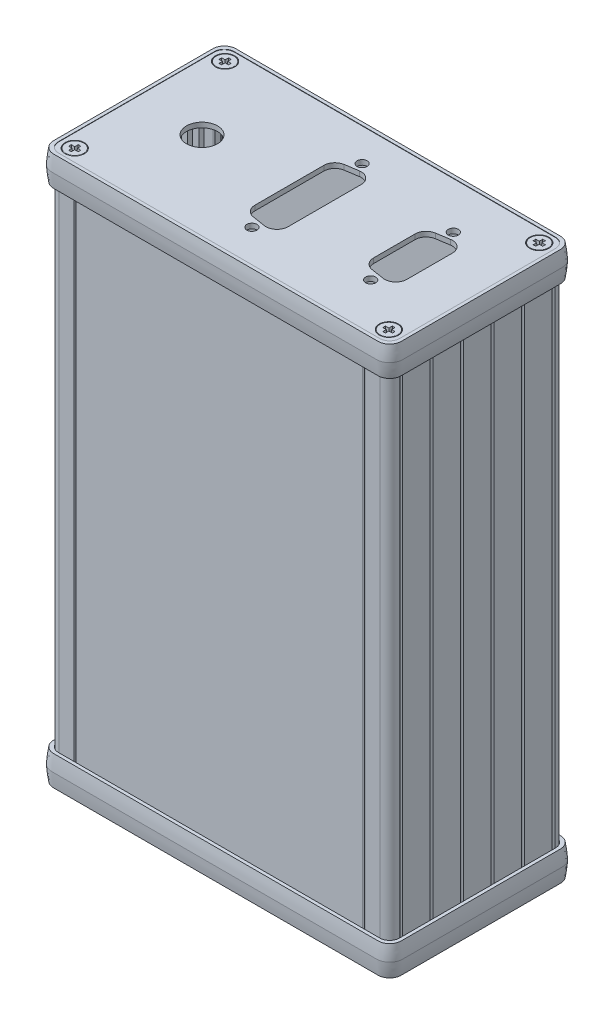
SolidWorks part; units mm, degrees
ref_plane "Front Plane" through (0, 0, 0) normal (0, 0, 1) x (1, 0, 0)
ref_plane "Top Plane" through (0, 0, 0) normal (0, 1, 0) x (1, 0, 0)
ref_plane "Right Plane" through (0, 0, 0) normal (1, 0, 0) x (0, 0, -1)
sketch "Sketch1" plane through (0, 0, 0) normal (0, 0, 1) x (1, 0, 0)
  line L0 (-53.065, -83) -> (53.065, -83)
  line L1 (-51.5, -80) -> (51.5, -80)
  line L2 (-51.5, -80) -> (-51.5, 80)
  line L3 (-51.5, 80) -> (51.5, 80)
  line L4 (51.5, -80) -> (51.5, 80)
  line L5 (0, 78.5) -> (0, -80) construction
  line L6 (-51.5, 0) -> (51.5, 0) construction
  line L7 (-53.065, 83) -> (53.065, 83)
  line L8 (-53.065, 83) -> (-53.065, 74)
  line L9 (-53.065, 74) -> (53.065, 74)
  line L10 (53.065, 83) -> (53.065, 74)
  line L11 (0, 78.5) -> (0, 83) construction
  line L12 (-53.065, 78.5) -> (53.065, 78.5) construction
  line L13 (53.065, -83) -> (53.065, -74)
  line L14 (-53.065, -74) -> (53.065, -74)
  line L15 (-53.065, -83) -> (-53.065, -74)
  point P0 (0, 0)
  point P4 (0, 78.5)
  point P11 (0, 81.3998)
  point P12 (0, 81.5)
  dimension "D1" = 9
  dimension "D2" = 1.5
  dimension "Width" = 103
  dimension "Height" = 160
  dimension "Bezel Width" = 106.13
  dimension "Inside Height" = 160
  dimension "D3" = 6
  dimension "Endplate Cover" = 1.6002
  dimension "D4" = 1.5
sketch "Sketch2" plane through (0, 0, 0) normal (0, 1, 0) x (1, 0, 0)
  line L0 (-53.065, 0) -> (53.065, 0) construction
  line L1 (-53.065, 0) -> (53.065, 0) construction
  line L3 (-51.5, -26.5) -> (51.5, -26.5)
  line L4 (-51.5, -26.5) -> (-51.5, 26.5)
  line L5 (-51.5, 26.5) -> (51.5, 26.5)
  line L6 (51.5, -26.5) -> (51.5, 26.5)
  line L7 (0, 26.5) -> (0, -26.5) construction
  line L8 (-51.5, 0) -> (51.5, 0) construction
  line L9 (-47.5, -24.81) -> (47.5, -24.81)
  line L10 (-47.5, -24.81) -> (-47.5, 24.81)
  line L11 (-47.5, 24.81) -> (47.5, 24.81)
  line L12 (47.5, -24.81) -> (47.5, 24.81)
  line L13 (0, 24.81) -> (0, -24.81) construction
  line L14 (-47.5, 0) -> (47.5, 0) construction
  line L15 (-47.5, -18.4) -> (-50, -18.4)
  line L16 (-50, -18.4) -> (-50, -16.4)
  line L17 (-50, -16.4) -> (-47.5, -16.4)
  line L18 (-47.5, -14.9) -> (-50, -14.9)
  line L19 (-50, -14.9) -> (-50, -12.9)
  line L20 (-50, -12.9) -> (-47.5, -12.9)
  line L21 (-47.5, -24.81) -> (-47.5, -18.4) construction
  point P2 (0, 0)
  point P8 (0, 0)
  point P15 (50, 0)
  point P18 (-50, 0)
  dimension "D1" = 6.41
  dimension "D2" = 2.5
  dimension "Depth" = 53
  dimension "Inside Depth" = 49.62
  dimension "Inside Width" = 95
  dimension "D4" = 100
  dimension "D6" = 2
  dimension "D7" = 1.5
sketch "Sketch3" plane through (0, 0, 0) normal (0, 1, 0) x (1, 0, 0)
  line L0 (0, 26.5) -> (0, -26.5) construction
  line L1 (-51.56, -26.545) -> (51.56, -26.545)
  line L2 (-51.56, -26.545) -> (-51.56, 26.545)
  line L3 (-51.56, 26.545) -> (51.56, 26.545)
  line L4 (51.56, -26.545) -> (51.56, 26.545)
  line L5 (0, 26.545) -> (0, -26.545) construction
  line L6 (-51.56, 0) -> (51.56, 0) construction
  circle A0 centre (-47.5, 22.735) radius 2.921
  circle A1 centre (-47.5, 22.735) radius 2.0955
  circle A2 centre (47.5, 22.735) radius 2.0955
  circle A3 centre (47.5, 22.735) radius 2.921
  point P0 (0, 0)
  dimension "D1" = 4.191
  dimension "D2" = 5.842
  dimension "Endplate Width" = 103.12
  dimension "Endplate Depth" = 53.09
  dimension "D3" = 45.47
  dimension "Mounting Hole Center to Center" = 95
sketch "Sketch4" plane through (0, 0, 0) normal (0, 1, 0) x (1, 0, 0)
  line L0 (-53.065, 0) -> (53.065, 0) construction
  line L1 (-53.065, -28.065) -> (53.065, -28.065)
  line L2 (-53.065, -28.065) -> (-53.065, 28.065)
  line L3 (-53.065, 28.065) -> (53.065, 28.065)
  line L4 (53.065, -28.065) -> (53.065, 28.065)
  line L5 (0, 28.065) -> (0, -28.065) construction
  line L6 (-53.065, 0) -> (53.065, 0) construction
  line L8 (-48.55, -24.35) -> (48.55, -24.35)
  line L9 (-48.55, -24.35) -> (-48.55, 24.35)
  line L10 (-48.55, 24.35) -> (48.55, 24.35)
  line L11 (48.55, -24.35) -> (48.55, 24.35)
  line L12 (0, 24.35) -> (0, -24.35) construction
  line L13 (-48.55, 0) -> (48.55, 0) construction
  line L14 (51.565, -26.565) -> (51.565, 26.565)
  line L15 (-51.565, 26.565) -> (51.565, 26.565)
  line L16 (-51.565, -26.565) -> (-51.565, 26.565)
  line L17 (-51.565, -26.565) -> (51.565, -26.565)
  point P0 (0, 0)
  point P6 (53.065, 0)
  point P7 (0, 0)
  point P21 (-47.5, 0)
  dimension "D1" = 97.1
  dimension "D2" = 48.7
  dimension "Bezel Depth" = 56.13
  dimension "D4" = 1.5
ref_plane "Plane1" through (0, 78.5, 0) normal (0, 1, 0) x (1, 0, 0)
sketch "Sketch5" plane through (0, 78.5, 0) normal (0, 1, 0) x (1, 0, 0)
  line L0 (53.065, -28.065) -> (53.065, 28.065) construction
  line L1 (-53.065, -28.065) -> (53.065, -28.065) construction
  line L2 (-53.065, 28.065) -> (53.065, 28.065) construction
  line L3 (-53.065, -28.065) -> (-53.065, 28.065) construction
  line L4 (53.065, -24.065) -> (53.065, 24.065)
  line L5 (-49.065, -28.065) -> (49.065, -28.065)
  line L6 (-49.065, 28.065) -> (49.065, 28.065)
  line L7 (-53.065, -24.065) -> (-53.065, 24.065)
  arc A0 (53.065, -24.065) -> (49.065, -28.065) centre (49.065, -24.065) cw
  arc A1 (53.065, 24.065) -> (49.065, 28.065) centre (49.065, 24.065) ccw
  arc A2 (-49.065, 28.065) -> (-53.065, 24.065) centre (-49.065, 24.065) ccw
  arc A3 (-49.065, -28.065) -> (-53.065, -24.065) centre (-49.065, -24.065) cw
  dimension "D1" = 4
ref_plane "Plane2" through (0, 83, 0) normal (0, 1, 0) x (1, 0, 0)
sketch "Sketch6" plane through (0, 83, 0) normal (0, 1, 0) x (1, 0, 0)
  line L0 (52.565, -24.065) -> (52.565, 24.065)
  line L1 (49.065, 27.565) -> (-49.065, 27.565)
  line L2 (-52.565, 24.065) -> (-52.565, -24.065)
  line L3 (-49.065, -27.565) -> (49.065, -27.565)
  line L4 (53.065, -24.065) -> (53.065, 24.065)
  line L5 (49.065, 28.065) -> (-49.065, 28.065)
  line L6 (-53.065, 24.065) -> (-53.065, -24.065)
  line L7 (-49.065, -28.065) -> (49.065, -28.065)
  line L8 (53.065, -24.065) -> (53.065, 24.065) construction
  line L9 (49.065, 28.065) -> (-49.065, 28.065) construction
  line L10 (-53.065, 24.065) -> (-53.065, -24.065) construction
  line L11 (-49.065, -28.065) -> (49.065, -28.065) construction
  arc A0 (52.565, 24.065) -> (49.065, 27.565) centre (49.065, 24.065) ccw
  arc A1 (-49.065, 27.565) -> (-52.565, 24.065) centre (-49.065, 24.065) ccw
  arc A2 (-52.565, -24.065) -> (-49.065, -27.565) centre (-49.065, -24.065) ccw
  arc A3 (49.065, -27.565) -> (52.565, -24.065) centre (49.065, -24.065) ccw
  arc A4 (53.065, 24.065) -> (49.065, 28.065) centre (49.065, 24.065) ccw
  arc A5 (-49.065, 28.065) -> (-53.065, 24.065) centre (-49.065, 24.065) ccw
  arc A6 (-53.065, -24.065) -> (-49.065, -28.065) centre (-49.065, -24.065) ccw
  arc A7 (49.065, -28.065) -> (53.065, -24.065) centre (49.065, -24.065) ccw
  arc A8 (53.065, 24.065) -> (49.065, 28.065) centre (49.065, 24.065) ccw construction
  arc A9 (-49.065, 28.065) -> (-53.065, 24.065) centre (-49.065, 24.065) ccw construction
  arc A10 (-53.065, -24.065) -> (-49.065, -28.065) centre (-49.065, -24.065) ccw construction
  arc A11 (49.065, -28.065) -> (53.065, -24.065) centre (49.065, -24.065) ccw construction
  dimension "D1" = 0
  dimension "D2" = 0.5
sketch "Sketch7" plane through (0, 0, 0) normal (0, 0, 1) x (1, 0, 0)
  line L2 (-53.065, 83) -> (-53.065, 74) construction
  arc A0 (-53.065, 78.5) -> (-52.565, 83) centre (-32.565, 78.5) cw
  point P0 (-52.565, 83)
sketch "Sketch8" plane through (0, 0, 0) normal (0, 0, 1) x (1, 0, 0)
  line L0 (0, 78.5) -> (0, 83) construction
  line L1 (0, 78.5) -> (0, 83) construction
  arc A0 (-52.565, 83) -> (-53.065, 78.5) centre (-32.565, 78.5) ccw construction
  arc A1 (-52.565, 83) -> (-53.065, 78.5) centre (-32.565, 78.5) ccw construction
  arc A2 (52.565, 83) -> (53.065, 78.5) centre (32.565, 78.5) cw
sketch "Sketch9" plane through (0, 0, 0) normal (1, 0, 0) x (0, 0, -1)
  line L0 (28.065, 78.5) -> (24.065, 78.5) construction
  line L1 (28.065, 78.5) -> (24.065, 78.5) construction
  line L2 (-24.065, 78.5) -> (24.065, 78.5) construction
  arc A0 (28.065, 78.5) -> (27.565, 83) centre (7.565, 78.5) ccw
  point P0 (27.565, 83)
sketch "Sketch10" plane through (0, 0, 0) normal (1, 0, 0) x (0, 0, -1)
  line L0 (0, 83) -> (0, 31.8992) construction
  line L1 (-24.065, 83) -> (24.065, 83) construction
  line L2 (0, 78.5) -> (0, 83) construction
  arc A0 (28.065, 78.5) -> (27.565, 83) centre (7.565, 78.5) ccw construction
  arc A1 (28.065, 78.5) -> (27.565, 83) centre (7.565, 78.5) ccw construction
  arc A2 (-28.065, 78.5) -> (-27.565, 83) centre (-7.565, 78.5) cw
loft "Loft1" add profiles "Sketch5", "Sketch6"
mirror "Mirror1" about plane through (49.065, 78.5, 24.065) normal (0, -1, 0)
sketch "Sketch11" plane through (0, 83, 0) normal (0, 1, 0) x (1, 0, 0)
  line L1 (-48.565, -26.565) -> (48.565, -26.565)
  line L2 (-51.565, -23.565) -> (-51.565, 23.565)
  line L3 (-48.565, 26.565) -> (48.565, 26.565)
  line L4 (51.565, -23.565) -> (51.565, 23.565)
  line L5 (0, 26.565) -> (0, -26.565) construction
  line L6 (-51.565, 0) -> (51.565, 0) construction
  line L7 (51.565, -26.565) -> (51.565, 26.565) construction
  line L9 (-53.065, 28.065) -> (53.065, 28.065) construction
  arc A0 (48.565, -26.565) -> (51.565, -23.565) centre (48.565, -23.565) ccw
  arc A1 (-48.565, -26.565) -> (-51.565, -23.565) centre (-48.565, -23.565) cw
  arc A2 (48.565, 26.565) -> (51.565, 23.565) centre (48.565, 23.565) cw
  arc A3 (-51.565, 23.565) -> (-48.565, 26.565) centre (-48.565, 23.565) cw
  point P12 (51.565, 26.565)
  dimension "D1" = 3
  dimension "D2" = 1.5
extrude "Cut-Extrude1" cut sketch "Sketch11" against normal up to vertex
sketch "Sketch12" plane through (0, 74, 0) normal (0, -1, 0) x (1, 0, 0)
  line L4 (48.565, 26.565) -> (-48.565, 26.565)
  line L5 (51.565, -23.565) -> (51.565, 23.565)
  line L6 (-48.565, -26.565) -> (48.565, -26.565)
  line L7 (-51.565, 23.565) -> (-51.565, -23.565)
  line L8 (48.565, 26.565) -> (-48.565, 26.565)
  line L9 (51.565, -23.565) -> (51.565, 23.565)
  line L10 (-48.565, -26.565) -> (48.565, -26.565)
  line L11 (-51.565, 23.565) -> (-51.565, -23.565)
  arc A4 (51.565, 23.565) -> (48.565, 26.565) centre (48.565, 23.565) ccw
  arc A5 (48.565, -26.565) -> (51.565, -23.565) centre (48.565, -23.565) ccw
  arc A6 (-51.565, -23.565) -> (-48.565, -26.565) centre (-48.565, -23.565) ccw
  arc A7 (-48.565, 26.565) -> (-51.565, 23.565) centre (-48.565, 23.565) ccw
  arc A8 (51.565, 23.565) -> (48.565, 26.565) centre (48.565, 23.565) ccw
  arc A9 (48.565, -26.565) -> (51.565, -23.565) centre (48.565, -23.565) ccw
  arc A10 (-51.565, -23.565) -> (-48.565, -26.565) centre (-48.565, -23.565) ccw
  arc A11 (-48.565, 26.565) -> (-51.565, 23.565) centre (-48.565, 23.565) ccw
  dimension "D1" = 0
extrude "Cut-Extrude2" cut sketch "Sketch12" against normal up to vertex
sketch "Sketch13" plane through (0, 81.3998, 0) normal (0, 1, 0) x (1, 0, 0)
  line L5 (-44.079, 22.735) -> (-44.079, 24.35)
  line L6 (-48.55, 24.35) -> (48.55, 24.35) construction
  line L17 (-47.5, 19.314) -> (-48.55, 19.314)
  line L18 (-48.55, -24.35) -> (-48.55, 24.35) construction
  line L19 (0, 26.545) -> (0, -26.545) construction
  line L20 (-51.56, 0) -> (51.56, 0) construction
  line L21 (0, 26.545) -> (0, -26.545) construction
  line L22 (-51.56, 0) -> (51.56, 0) construction
  line L23 (47.5, 19.314) -> (48.55, 19.314)
  line L24 (44.079, 22.735) -> (44.079, 24.35)
  line L25 (44.079, -22.735) -> (44.079, -24.35)
  line L26 (47.5, -19.314) -> (48.55, -19.314)
  line L27 (-47.5, -19.314) -> (-48.55, -19.314)
  line L28 (-44.079, -22.735) -> (-44.079, -24.35)
  line L29 (-48.55, -19.314) -> (-48.55, 19.314)
  line L30 (-44.079, -24.35) -> (44.079, -24.35)
  line L31 (48.55, -19.314) -> (48.55, 19.314)
  line L32 (44.079, 24.35) -> (-44.079, 24.35)
  arc A12 (-47.5, 19.314) -> (-44.079, 22.735) centre (-47.5, 22.735) ccw
  arc A13 (47.5, 19.314) -> (44.079, 22.735) centre (47.5, 22.735) cw
  arc A14 (47.5, -19.314) -> (44.079, -22.735) centre (47.5, -22.735) ccw
  arc A15 (-47.5, -19.314) -> (-44.079, -22.735) centre (-47.5, -22.735) cw
  circle A16 centre (-47.5, 22.735) radius 2.0955 construction
  circle A17 centre (47.5, 22.735) radius 2.0955 construction
  circle A18 centre (-47.5, 22.735) radius 2.0955
  circle A19 centre (47.5, 22.735) radius 2.0955
  circle A20 centre (47.5, -22.735) radius 2.0955
  circle A21 centre (-47.5, -22.735) radius 2.0955
  circle A22 centre (-47.5, 22.735) radius 2.921 construction
  dimension "D1" = 0.5
extrude "Cut-Extrude3" cut sketch "Sketch13" against normal through all
sketch "Sketch14" plane through (0, 81.3998, 0) normal (0, 1, 0) x (1, 0, 0)
  line L0 (51.56, -26.545) -> (51.56, 26.545) construction
  line L1 (-51.56, -26.545) -> (51.56, -26.545) construction
  line L2 (-51.56, -26.545) -> (-51.56, 26.545) construction
  line L3 (-51.56, 26.545) -> (51.56, 26.545) construction
  line L8 (51.56, -23.545) -> (51.56, 23.545)
  line L9 (48.56, 26.545) -> (-48.56, 26.545)
  line L10 (-51.56, 23.545) -> (-51.56, -23.545)
  line L11 (-48.56, -26.545) -> (48.56, -26.545)
  circle A2 centre (47.5, 22.735) radius 2.0955
  circle A3 centre (-47.5, 22.735) radius 2.0955
  circle A4 centre (-47.5, 22.735) radius 2.0955 construction
  circle A5 centre (-47.5, -22.735) radius 2.0955 construction
  circle A6 centre (47.5, 22.735) radius 2.0955 construction
  circle A7 centre (47.5, -22.735) radius 2.0955 construction
  arc A8 (48.56, -26.545) -> (51.56, -23.545) centre (48.56, -23.545) ccw
  arc A9 (51.56, 23.545) -> (48.56, 26.545) centre (48.56, 23.545) ccw
  arc A10 (-48.56, 26.545) -> (-51.56, 23.545) centre (-48.56, 23.545) ccw
  arc A11 (-51.56, -23.545) -> (-48.56, -26.545) centre (-48.56, -23.545) ccw
  circle A14 centre (-47.5, -22.735) radius 2.0955
  circle A15 centre (47.5, -22.735) radius 2.0955
  dimension "D1" = 3
extrude "Boss-Extrude1" add sketch "Sketch14" along normal blind 1.5 separate body
sketch "Sketch15" plane through (0, 82.8998, 0) normal (0, 1, 0) x (1, 0, 0)
  line L0 (-51.56, 0) -> (51.56, 0) construction
  line L1 (-51.56, 0) -> (51.56, 0) construction
  circle A0 centre (47.5, 22.735) radius 2.921 construction
  circle A1 centre (-47.5, 22.735) radius 2.921 construction
  circle A2 centre (47.5, 22.735) radius 2.921
  circle A3 centre (-47.5, 22.735) radius 2.921
  circle A4 centre (-47.5, -22.735) radius 2.921
  circle A5 centre (47.5, -22.735) radius 2.921
extrude "Cut-Extrude4" cut sketch "Sketch15" against normal blind 1.63 draft 41
sketch "Sketch16" plane through (0, 82.8998, 0) normal (0, 1, 0) x (1, 0, 0)
  circle A0 centre (47.5, 22.735) radius 2.921 construction
  circle A1 centre (-47.5, 22.735) radius 2.921 construction
  circle A2 centre (47.5, 22.735) radius 2.921
  circle A3 centre (-47.5, 22.735) radius 2.921
extrude "Boss-Extrude2" add sketch "Sketch16" against normal blind 1.63 draft 41 separate body
fillet "Fillet1" radius 0.1 1 edges at (-47.5, 82.8998, -19.814)
fillet "Fillet2" radius 0.1 1 edges at (47.5, 82.8998, -19.814)
sketch "Sketch17" plane through (0, 82.8998, 0) normal (0, 1, 0) x (1, 0, 0)
  line L0 (0, 26.5) -> (0, -26.5) construction
  line L1 (-47.9, 21.285) -> (-47.1, 21.285)
  line L2 (-47.9, 21.285) -> (-47.9, 24.185)
  line L3 (-47.9, 24.185) -> (-47.1, 24.185)
  line L4 (-47.1, 21.285) -> (-47.1, 24.185)
  line L5 (-47.5, 24.185) -> (-47.5, 21.285) construction
  line L6 (-47.9, 22.735) -> (-47.1, 22.735) construction
  line L7 (-48.95, 22.335) -> (-46.05, 22.335)
  line L8 (-48.95, 22.335) -> (-48.95, 23.135)
  line L9 (-48.95, 23.135) -> (-46.05, 23.135)
  line L10 (-46.05, 22.335) -> (-46.05, 23.135)
  line L11 (-47.5, 23.135) -> (-47.5, 22.335) construction
  line L12 (-48.95, 22.735) -> (-46.05, 22.735) construction
  line L13 (0, 26.5) -> (0, -26.5) construction
  line L14 (48.95, 22.735) -> (46.05, 22.735) construction
  line L15 (47.5, 23.135) -> (47.5, 22.335) construction
  line L16 (47.9, 22.735) -> (47.1, 22.735) construction
  line L17 (47.5, 24.185) -> (47.5, 21.285) construction
  line L18 (46.05, 22.335) -> (46.05, 23.135)
  line L19 (48.95, 23.135) -> (46.05, 23.135)
  line L20 (48.95, 22.335) -> (48.95, 23.135)
  line L21 (48.95, 22.335) -> (46.05, 22.335)
  line L22 (47.1, 21.285) -> (47.1, 24.185)
  line L23 (47.9, 24.185) -> (47.1, 24.185)
  line L24 (47.9, 21.285) -> (47.9, 24.185)
  line L25 (47.9, 21.285) -> (47.1, 21.285)
  point P0 (-47.5, 22.735)
  point P4 (-47.5, 22.735)
  point P32 (47.5, 22.735)
  dimension "D1" = 0.8
  dimension "D2" = 2.9
extrude "Cut-Extrude5" cut sketch "Sketch17" against normal blind 1.2 draft 3 contours L4 L3 L2 L1 | L9 L10 L7 L8 | L22 L23 L24 L25 | L19 L18 L21 L20
mirror "Mirror2" about plane through (0, 0, 0) normal (0, 1, 0)
mirror "Mirror3" about plane through (0, 0, 0) normal (0, 0, 1)
sketch "Sketch18" plane through (0, 78.5, 0) normal (0, -1, 0) x (1, 0, 0)
  line L0 (-46.1694, 24.3998) -> (-46.1694, 22.7098)
  line L1 (-46.1694, 22.7098) -> (-41.9, 22.7098)
  line L2 (-41.9, 22.7098) -> (-41.9, 24.81)
  line L3 (-47.5, 24.81) -> (47.5, 24.81) construction
  line L4 (-51.5, 26.5) -> (-51.5, -26.5) construction
  line L5 (51.5, 26.5) -> (51.5, -26.5) construction
  line L6 (-51.5, -26.5) -> (51.5, -26.5) construction
  line L7 (41.9, 24.81) -> (41.9, 26.5) construction
  line L8 (-51.5, 23.5) -> (-51.5, -23.5)
  line L9 (-48.5, -26.5) -> (48.5, -26.5)
  line L10 (51.5, -23.5) -> (51.5, 23.5)
  line L11 (48.5, 26.5) -> (43.69, 26.5)
  line L16 (-50, 12.9) -> (-47.5, 12.9) construction
  line L17 (-50, 14.9) -> (-50, 12.9) construction
  line L18 (-47.5, 14.9) -> (-50, 14.9) construction
  line L19 (-50, 16.4) -> (-47.5, 16.4) construction
  line L20 (-50, 18.4) -> (-50, 16.4) construction
  line L21 (-47.5, 18.4) -> (-50, 18.4) construction
  line L22 (-50, 12.9) -> (-47.5, 12.9)
  line L23 (-50, 14.9) -> (-50, 12.9)
  line L24 (-47.5, 14.9) -> (-50, 14.9)
  line L25 (-50, 16.4) -> (-47.5, 16.4)
  line L26 (-50, 18.4) -> (-50, 16.4)
  line L27 (-47.5, 18.4) -> (-50, 18.4)
  line L28 (-47.5, 16.4) -> (-47.5, 14.9)
  line L30 (-8.7763, 0) -> (-50, 0) construction
  line L31 (-53.065, 0) -> (53.065, 0) construction
  line L32 (-47.5, -16.4) -> (-47.5, -14.9)
  line L33 (-47.5, -18.4) -> (-50, -18.4)
  line L34 (-50, -18.4) -> (-50, -16.4)
  line L35 (-50, -16.4) -> (-47.5, -16.4)
  line L36 (-47.5, -14.9) -> (-50, -14.9)
  line L37 (-50, -14.9) -> (-50, -12.9)
  line L38 (-50, -12.9) -> (-47.5, -12.9)
  line L40 (-47.5, -14.9) -> (-47.5, -16.4)
  line L41 (0, 0) -> (0, 7.1948) construction
  line L42 (0, -26.5) -> (0, 26.5) construction
  line L43 (-41.9, 24.81) -> (41.9, 24.81)
  line L44 (-47.5, 22.735) -> (-48.9817, 21.2533) construction
  line L45 (-47.5, 18.4) -> (-47.5, 24.81) construction
  line L46 (-50, 18.4) -> (-43.59, 18.4) construction
  line L47 (-49.5976, 21.4044) -> (-48.8306, 20.6374)
  line L48 (-48.8306, 20.6374) -> (-48.5477, 20.9202)
  line L49 (-49.5976, 21.4044) -> (-49.3148, 21.6872)
  line L50 (-48.5477, 20.9202) -> (-47.5, 22.735) construction
  line L51 (-48.8306, 24.8326) -> (-49.5976, 24.0656)
  line L52 (-49.5976, 24.0656) -> (-49.3148, 23.7827)
  line L53 (-48.8306, 24.8326) -> (-48.5478, 24.5498)
  line L55 (-46.1694, 24.8326) -> (-46.4523, 24.5498) construction
  line L57 (-46.1694, 20.6374) -> (-45.4024, 21.4044)
  line L58 (-45.4024, 21.4044) -> (-45.6852, 21.6873)
  line L59 (-46.1694, 20.6374) -> (-46.4522, 20.9202)
  line L60 (-48.5477, -20.9202) -> (-47.5, -22.735) construction
  line L61 (-47.5, -22.735) -> (-48.9817, -21.2533) construction
  line L62 (-43.165, -24.81) -> (43.165, -24.81)
  line L63 (-46.1694, -20.6374) -> (-46.4522, -20.9202) construction
  line L64 (-51.5, 26.5) -> (51.5, 26.5) construction
  line L65 (-50, 12.9) -> (-47.5, 12.9)
  line L66 (-50, -12.9) -> (-47.5, -12.9)
  line L67 (-45.4024, -21.4044) -> (-45.6852, -21.6873) construction
  line L68 (-46.1694, -20.6374) -> (-45.4024, -21.4044) construction
  line L69 (-45.4024, -24.0656) -> (-45.6852, -23.7827)
  line L70 (-46.1694, -24.8326) -> (-46.4523, -24.5498)
  line L71 (-45.4024, -24.0656) -> (-46.1694, -24.8326)
  line L72 (-48.8306, -24.8326) -> (-48.5478, -24.5498)
  line L73 (-49.5976, -24.0656) -> (-49.3148, -23.7827)
  line L74 (-48.8306, -24.8326) -> (-49.5976, -24.0656)
  line L75 (-49.5976, -21.4044) -> (-49.3148, -21.6872)
  line L76 (-48.8306, -20.6374) -> (-48.5477, -20.9202)
  line L77 (-49.5976, -21.4044) -> (-48.8306, -20.6374)
  line L78 (41.9, 24.81) -> (43.59, 24.81) construction
  line L79 (43.69, 24.5038) -> (43.6757, 24.4898) construction
  line L92 (46.1694, -20.6374) -> (45.4024, -21.4044) construction
  line L93 (45.4024, -21.4044) -> (45.6852, -21.6873) construction
  line L106 (-41.9, 24.81) -> (-41.9, 26.5) construction
  line L107 (-45.4024, 24.0656) -> (-45.6852, 23.7828)
  line L108 (-45.4024, 24.0656) -> (-46.1694, 24.8326)
  line L109 (-46.4523, 24.5498) -> (-43.69, 24.5498)
  line L110 (-43.69, 24.5038) -> (-43.69, 26.5) construction
  line L111 (-45.4118, 22.5598) -> (-43.59, 22.5598)
  line L112 (-47.5, 18.4) -> (-43.59, 18.4) construction
  line L113 (-43.59, 18.4) -> (-43.59, 22.5598) construction
  line L114 (-43.59, 26.5) -> (-43.59, 24.6998)
  line L115 (-43.69, 26.5) -> (-48.5, 26.5)
  line L116 (-43.89, 24.3998) -> (-46.1694, 24.3998)
  line L117 (-43.69, 24.5038) -> (-43.6757, 24.4898) construction
  line L118 (-41.9, 24.81) -> (-43.59, 24.81) construction
  line L119 (46.1694, 24.8326) -> (46.4523, 24.5498) construction
  line L120 (48.5478, 20.9202) -> (47.5, 22.735) construction
  line L121 (50, 18.4) -> (43.59, 18.4) construction
  line L122 (47.5, 18.4) -> (47.5, 24.81) construction
  line L123 (47.5, 22.735) -> (48.9817, 21.2533) construction
  line L124 (43.89, 24.3998) -> (46.1694, 24.3998)
  line L125 (43.59, 18.4) -> (43.59, 22.5598) construction
  line L126 (47.5, 18.4) -> (43.59, 18.4) construction
  line L127 (45.4118, 22.5598) -> (43.59, 22.5598)
  line L128 (46.4523, 24.5498) -> (43.69, 24.5498)
  line L129 (46.1694, 20.6374) -> (46.4523, 20.9202)
  line L130 (45.4024, 21.4044) -> (45.6852, 21.6873)
  line L131 (46.1694, 20.6374) -> (45.4024, 21.4044)
  line L132 (48.8306, 24.8326) -> (48.5478, 24.5498)
  line L133 (49.5976, 24.0656) -> (49.3148, 23.7827)
  line L134 (48.8306, 24.8326) -> (49.5976, 24.0656)
  line L135 (49.5976, 21.4044) -> (49.3148, 21.6872)
  line L136 (48.8306, 20.6374) -> (48.5478, 20.9202)
  line L137 (49.5976, 21.4044) -> (48.8306, 20.6374)
  line L138 (47.5, 18.4) -> (50, 18.4)
  line L139 (41.9, 22.7098) -> (41.9, 24.81)
  line L140 (46.1694, 22.7098) -> (41.9, 22.7098)
  line L141 (46.1694, 24.3998) -> (46.1694, 22.7098)
  line L142 (-43.69, 24.5498) -> (-43.69, 26.5)
  line L143 (43.59, 24.6998) -> (43.59, 26.5)
  line L144 (43.69, 24.5498) -> (43.69, 26.5)
  line L145 (43.59, 26.5) -> (-43.59, 26.5)
  line L146 (-47.5, 12.9) -> (-47.5, 11.4)
  line L147 (-47.5, 24.81) -> (-47.5, -24.81) construction
  line L148 (-47.5, 11.4) -> (-50, 11.4)
  line L149 (-50, 11.4) -> (-50, -11.4) construction
  line L150 (-50, -11.4) -> (-47.5, -11.4)
  line L151 (-47.5, -11.4) -> (-47.5, -12.9)
  line L152 (-47.5, -20.6395) -> (-46.4522, -20.6395)
  line L153 (-46.4522, -20.6395) -> (-46.4523, -18.4)
  line L154 (-46.4523, -18.4) -> (-47.5, -18.4)
  line L155 (-45.4045, -22.735) -> (-45.4045, -21.6872)
  line L156 (-45.4045, -21.6872) -> (-43.165, -21.6873)
  line L157 (-43.165, -21.6873) -> (-43.165, -24.81)
  line L158 (-47.5, -24.81) -> (47.5, -24.81) construction
  line L159 (46.1694, -20.6374) -> (46.4523, -20.9202) construction
  line L160 (47.5, -22.735) -> (48.9817, -21.2533) construction
  line L161 (48.5478, -20.9202) -> (47.5, -22.735) construction
  line L162 (43.165, -21.6873) -> (43.165, -24.81)
  line L163 (45.4045, -21.6872) -> (43.165, -21.6873)
  line L164 (45.4045, -22.735) -> (45.4045, -21.6872)
  line L165 (46.4523, -18.4) -> (47.5, -18.4)
  line L166 (46.4523, -20.6395) -> (46.4523, -18.4)
  line L167 (47.5, -20.6395) -> (46.4523, -20.6395)
  line L168 (47.5, -11.4) -> (47.5, -12.9)
  line L169 (50, -11.4) -> (47.5, -11.4)
  line L170 (50, 11.4) -> (50, -11.4) construction
  line L171 (47.5, 11.4) -> (50, 11.4)
  line L172 (47.5, 12.9) -> (47.5, 11.4)
  line L173 (49.5976, -21.4044) -> (48.8306, -20.6374)
  line L174 (48.8306, -20.6374) -> (48.5478, -20.9202)
  line L175 (49.5976, -21.4044) -> (49.3148, -21.6872)
  line L176 (48.8306, -24.8326) -> (49.5976, -24.0656)
  line L177 (49.5976, -24.0656) -> (49.3148, -23.7827)
  line L178 (48.8306, -24.8326) -> (48.5478, -24.5498)
  line L179 (45.4024, -24.0656) -> (46.1694, -24.8326)
  line L180 (46.1694, -24.8326) -> (46.4523, -24.5498)
  line L181 (45.4024, -24.0656) -> (45.6852, -23.7827)
  line L182 (50, -12.9) -> (47.5, -12.9)
  line L183 (50, 12.9) -> (47.5, 12.9)
  line L184 (47.5, -14.9) -> (47.5, -16.4)
  line L185 (50, -12.9) -> (47.5, -12.9)
  line L186 (50, -14.9) -> (50, -12.9)
  line L187 (47.5, -14.9) -> (50, -14.9)
  line L188 (50, -16.4) -> (47.5, -16.4)
  line L189 (50, -18.4) -> (50, -16.4)
  line L190 (47.5, -18.4) -> (50, -18.4)
  line L191 (47.5, -16.4) -> (47.5, -14.9)
  line L192 (50, 12.9) -> (47.5, 12.9)
  line L193 (50, 14.9) -> (50, 12.9)
  line L194 (50, 18.4) -> (50, 16.4)
  line L195 (47.5, 16.4) -> (47.5, 14.9)
  line L196 (50, 16.4) -> (47.5, 16.4)
  line L197 (47.5, 14.9) -> (50, 14.9)
  line L198 (47.5, 18.4) -> (43.59, 20.4799)
  line L199 (43.59, 20.4799) -> (43.59, 22.5598)
  line L200 (-43.59, 22.5598) -> (-43.59, 20.4799)
  line L201 (-43.59, 20.4799) -> (-47.5, 18.4)
  line L202 (47.5, 7.9) -> (50, 7.9)
  line L203 (47.5, 9.4) -> (47.5, 7.9)
  line L204 (50, 9.4) -> (47.5, 9.4)
  line L205 (50, 9.4) -> (47.5, 9.4)
  line L206 (50, 11.4) -> (50, 9.4)
  line L207 (47.5, 4.4) -> (50, 4.4)
  line L208 (47.5, 5.9) -> (47.5, 4.4)
  line L209 (50, 5.9) -> (47.5, 5.9)
  line L210 (50, 5.9) -> (47.5, 5.9)
  line L211 (50, 7.9) -> (50, 5.9)
  line L212 (47.5, 0.9) -> (50, 0.9)
  line L213 (47.5, 2.4) -> (47.5, 0.9)
  line L214 (50, 2.4) -> (47.5, 2.4)
  line L215 (50, 2.4) -> (47.5, 2.4)
  line L216 (50, 4.4) -> (50, 2.4)
  line L217 (47.5, -2.6) -> (50, -2.6)
  line L218 (47.5, -1.1) -> (47.5, -2.6)
  line L219 (50, -1.1) -> (47.5, -1.1)
  line L220 (50, -1.1) -> (47.5, -1.1)
  line L221 (50, 0.9) -> (50, -1.1)
  line L222 (47.5, -6.1) -> (50, -6.1)
  line L223 (47.5, -4.6) -> (47.5, -6.1)
  line L224 (50, -4.6) -> (47.5, -4.6)
  line L225 (50, -4.6) -> (47.5, -4.6)
  line L226 (50, -2.6) -> (50, -4.6)
  line L227 (47.5, -9.6) -> (50, -9.6)
  line L228 (47.5, -8.1) -> (47.5, -9.6)
  line L229 (50, -8.1) -> (47.5, -8.1)
  line L230 (50, -8.1) -> (47.5, -8.1)
  line L231 (50, -6.1) -> (50, -8.1)
  line L232 (-50, -6.1) -> (-50, -8.1)
  line L233 (-50, -8.1) -> (-47.5, -8.1)
  line L234 (-50, -8.1) -> (-47.5, -8.1)
  line L235 (-47.5, -8.1) -> (-47.5, -9.6)
  line L236 (-47.5, -9.6) -> (-50, -9.6)
  line L237 (-50, -2.6) -> (-50, -4.6)
  line L238 (-50, -4.6) -> (-47.5, -4.6)
  line L239 (-50, -4.6) -> (-47.5, -4.6)
  line L240 (-47.5, -4.6) -> (-47.5, -6.1)
  line L241 (-47.5, -6.1) -> (-50, -6.1)
  line L242 (-50, 0.9) -> (-50, -1.1)
  line L243 (-50, -1.1) -> (-47.5, -1.1)
  line L244 (-50, -1.1) -> (-47.5, -1.1)
  line L245 (-47.5, -1.1) -> (-47.5, -2.6)
  line L246 (-47.5, -2.6) -> (-50, -2.6)
  line L247 (-50, 4.4) -> (-50, 2.4)
  line L248 (-50, 2.4) -> (-47.5, 2.4)
  line L249 (-50, 2.4) -> (-47.5, 2.4)
  line L250 (-47.5, 2.4) -> (-47.5, 0.9)
  line L251 (-47.5, 0.9) -> (-50, 0.9)
  line L252 (-50, 7.9) -> (-50, 5.9)
  line L253 (-50, 5.9) -> (-47.5, 5.9)
  line L254 (-50, 5.9) -> (-47.5, 5.9)
  line L255 (-47.5, 5.9) -> (-47.5, 4.4)
  line L256 (-47.5, 4.4) -> (-50, 4.4)
  line L257 (-50, 9.4) -> (-47.5, 9.4)
  line L258 (-50, 9.4) -> (-47.5, 9.4)
  line L259 (-47.5, 9.4) -> (-47.5, 7.9)
  line L260 (-47.5, 7.9) -> (-50, 7.9)
  line L261 (-50, 9.4) -> (-50, 11.4)
  line L262 (-50, -11.4) -> (-50, -9.6)
  line L263 (50, -11.4) -> (50, -9.6)
  circle A0 centre (-47.5, 22.735) radius 2.0955 construction
  circle A1 centre (47.5, 22.735) radius 2.0955 construction
  circle A3 centre (-47.5, -22.735) radius 2.0955 construction
  arc A8 (-48.5, 26.5) -> (-51.5, 23.5) centre (-48.5, 23.5) ccw
  arc A9 (-51.5, -23.5) -> (-48.5, -26.5) centre (-48.5, -23.5) ccw
  arc A10 (48.5, -26.5) -> (51.5, -23.5) centre (48.5, -23.5) ccw
  arc A11 (51.5, 23.5) -> (48.5, 26.5) centre (48.5, 23.5) ccw
  arc A12 (-49.3148, 21.6872) -> (-49.3148, 23.7827) centre (-47.5, 22.735) cw
  arc A13 (-48.5477, 20.9202) -> (-46.4522, 20.9202) centre (-47.5, 22.735) ccw
  arc A15 (-46.4523, 24.5498) -> (-48.5478, 24.5498) centre (-47.5, 22.735) ccw
  circle A16 centre (-47.5, -22.735) radius 2.0955 construction
  arc A17 (-46.4523, -24.5498) -> (-48.5478, -24.5498) centre (-47.5, -22.735) cw
  arc A18 (-45.6852, -21.6873) -> (-45.6852, -23.7827) centre (-47.5, -22.735) cw construction
  arc A19 (-48.5477, -20.9202) -> (-46.4522, -20.9202) centre (-47.5, -22.735) cw construction
  arc A20 (-49.3148, -21.6872) -> (-49.3148, -23.7827) centre (-47.5, -22.735) ccw
  arc A21 (43.59, 24.6998) -> (43.89, 24.3998) centre (43.89, 24.6998) ccw
  arc A26 (48.5478, -20.9202) -> (46.4523, -20.9202) centre (47.5, -22.735) ccw construction
  arc A31 (-45.6852, 21.6873) -> (-45.4118, 22.5598) centre (-47.5, 22.735) ccw
  arc A32 (-43.59, 24.6998) -> (-43.89, 24.3998) centre (-43.89, 24.6998) cw
  arc A33 (45.6852, 21.6873) -> (45.4118, 22.5598) centre (47.5, 22.735) cw
  arc A34 (46.4523, 24.5498) -> (48.5478, 24.5498) centre (47.5, 22.735) cw
  arc A35 (48.5478, 20.9202) -> (46.4523, 20.9202) centre (47.5, 22.735) cw
  arc A36 (49.3148, 21.6872) -> (49.3148, 23.7827) centre (47.5, 22.735) ccw
  arc A37 (-48.5477, -20.9202) -> (-47.5, -20.6395) centre (-47.5, -22.735) cw
  arc A38 (-45.6852, -23.7827) -> (-45.4045, -22.735) centre (-47.5, -22.735) ccw
  arc A39 (45.6852, -21.6873) -> (45.6852, -23.7827) centre (47.5, -22.735) ccw construction
  circle A40 centre (47.5, -22.735) radius 2.0955 construction
  arc A41 (45.6852, -23.7827) -> (45.4045, -22.735) centre (47.5, -22.735) cw
  arc A42 (48.5478, -20.9202) -> (47.5, -20.6395) centre (47.5, -22.735) ccw
  arc A43 (49.3148, -21.6872) -> (49.3148, -23.7827) centre (47.5, -22.735) cw
  arc A44 (46.4523, -24.5498) -> (48.5478, -24.5498) centre (47.5, -22.735) ccw
  point P53 (-49.2141, 21.0209)
  point P60 (-49.2141, 24.4491)
  point P66 (-45.7859, 24.4491)
  point P72 (-45.7859, 21.0209)
  point P76 (-47.5, 22.735)
  point P101 (-45.7859, -21.0209)
  point P102 (-45.7859, -24.4491)
  point P103 (-49.2141, -24.4491)
  point P104 (-49.2141, -21.0209)
  point P175 (45.7859, 21.0209)
  point P176 (45.7859, 24.4491)
  point P177 (49.2141, 24.4491)
  point P178 (49.2141, 21.0209)
  point P214 (49.2141, -21.0209)
  point P215 (49.2141, -24.4491)
  point P216 (45.7859, -24.4491)
  point P217 (45.7859, -21.0209)
  dimension "D2" = 45
  dimension "D6" = 0.1
  dimension "D7" = 0.15
  dimension "D8" = 0.15
  dimension "D9" = 0.02
  dimension "D11" = 3
  dimension "D3" = 15
  dimension "D4" = 0.4
  dimension "D10" = 0.15
  dimension "D12" = 7
  dimension "D5" = 4
extrude "Boss-Extrude3" add sketch "Sketch18" along normal up to surface (157 mm away) separate body contours L10 A11 L11 L144 L128 L132 L134 L133 L135 L137 L136 L129 L131 L130 L127 L138 L194 L196 L197 L193 L183 L171 L206 L204 L202 L211 L209 L207 L216 L214 L212 L221 L219 L217 L226 L224 L222 M117 M128 M129 M130 | L188 L187 L184 M130 | L182 L169 L168 M130 | L229 L228 L227 M130 | L224 L223 L222 M130 | L219 L218 L217 M130 | L214 L213 L212 M130 | L209 L208 L207 M130 | L204 L203 L202 M130 | L183 L172 L171 M130 | L195 L197 L196 M130 | L199 L198 L138 L127 M130 M129 M128 | L114 A32 L116 L0 L1 L2 L43 L139 L140 L141 L124 A21 L143 L145 M116 M125 M126 M127 M117 | L201 L200 L111 L27 M124 M123 M122 | L28 L25 L24 M122 | L148 L146 L22 M122 | L260 L259 L257 M122 | L251 L250 L248 M122 | L256 L255 L253 M122 | L246 L245 L243 M122 | L241 L240 L238 M122 | L236 L235 L233 M122 | L151 L150 L38 M122 | L32 L36 L35 M122 | L140 L139 M127 M126 | L1 L2 M126 M125 | L157 L156 M120 M135 M134 | L153 L154 L33 M122 M121 M120 | L163 L162 M132 M134 M133 | L190 L165 L166 M132 M131 M130 | L0 L1 M116 | L141 L140 M117
fillet "Fillet3" radius 0.3 18 edges at (43.69, 0, 24.5498) (46.4523, 0, -18.4) (46.4523, 0, -20.6395) (43.165, 0, -21.6873) (45.4045, 0, -21.6872) (-43.69, 0, 24.5498) (-43.165, 0, -21.6873) (-45.4045, 0, -21.6872) (-46.4522, 0, -20.6395) (-46.4523, 0, -18.4) (-47.5, 0, 18.4) (-43.59, 0, 20.4799) (-43.59, 0, 22.5598) (-43.69, 0, 26.5) (43.69, 0, 26.5) (43.59, 0, 22.5598) (47.5, 0, 18.4) (43.59, 0, 20.4799)
fillet "Fillet4" radius 0.3 8 edges at (-46.1694, 0, 22.7098) (-46.1694, 0, 24.3998) (-43.59, 0, 26.5) (-41.9, 0, 22.7098) (41.9, 0, 22.7098) (43.59, 0, 26.5) (46.1694, 0, 24.3998) (46.1694, 0, 22.7098)
sketch "Sketch19" plane through (0, 0, 0) normal (0, 1, 0) x (1, 0, 0)
  line L1 (51.565, 23.565) -> (51.565, -23.565) construction
  line L2 (51.5, 23.5) -> (51.5, -23.5)
  line L3 (51.5, 23.5) -> (51.5, -23.5) construction
  line L5 (51.565, 4.6) -> (51.565, -4.6) construction
  line L6 (51.565, 0) -> (0, 0) construction
  line L7 (0, 0) -> (0, 20.2931) construction
  circle A0 centre (51.565, 23) radius 0.45
  circle A1 centre (51.565, 13.8) radius 0.45
  circle A2 centre (51.565, 4.6) radius 0.45
  circle A3 centre (51.565, -4.6) radius 0.45
  circle A4 centre (51.565, -13.8) radius 0.45
  circle A5 centre (51.565, -23) radius 0.45
  circle A6 centre (-51.565, -23) radius 0.45
  circle A7 centre (-51.565, -13.8) radius 0.45
  circle A8 centre (-51.565, -4.6) radius 0.45
  circle A9 centre (-51.565, 4.6) radius 0.45
  circle A10 centre (-51.565, 13.8) radius 0.45
  circle A11 centre (-51.565, 23) radius 0.45
  point P20 (50, 4.6)
  dimension "D1" = 0.9
  dimension "D2" = 6
extrude "Cut-Extrude6" cut sketch "Sketch19" against normal through all both and the other way through all
sketch "Sketch20" plane through (0, 82.8998, 0) normal (0, 1, 0) x (1, 0, 0)
  line L0 (0, -30.8833) -> (0, 30.8833) construction
  circle A0 centre (-31.75, 0) radius 4.699
  dimension "D1" = 9.398
  dimension "D2" = 31.75
extrude "Cut-Extrude7" cut sketch "Sketch20" against normal blind 2.54
sketch "Sketch21" plane through (0, 82.8998, 0) normal (0, 1, 0) x (1, 0, 0)
  line L0 (-58.3833, 0) -> (58.3833, 0) construction
  line L1 (0, -30.8833) -> (0, 30.8833) construction
  point P4 (0, 16.6624)
  line B0 (37.084, -6.8834) -> (37.084, 6.8834)
  line B1 (33.2067, 10.1949) -> (29.2443, 9.5673)
  line B2 (26.416, 6.2558) -> (26.416, -6.2558)
  line B3 (33.2067, -10.1949) -> (29.2443, -9.5673)
  circle B4 centre (31.75, 12.4968) radius 1.524
  arc B5 (26.416, 6.2558) -> (29.2443, 9.5673) centre (29.7688, 6.2558) cw
  arc B6 (33.2067, 10.1949) -> (37.084, 6.8834) centre (33.7312, 6.8834) cw
  arc B7 (33.2067, -10.1949) -> (37.084, -6.8834) centre (33.7312, -6.8834) ccw
  arc B8 (26.416, -6.2558) -> (29.2443, -9.5673) centre (29.7688, -6.2558) ccw
  circle B9 centre (31.75, -12.4968) radius 1.524
  line B10 (31.75, 12.4968) -> (31.75, -12.4968) construction
  line B11 (5.334, -11.049) -> (5.334, 11.049)
  line B12 (1.4567, 14.3605) -> (-2.5057, 13.7329)
  line B13 (-5.334, 10.4214) -> (-5.334, -10.4214)
  line B14 (1.4567, -14.3605) -> (-2.5057, -13.7329)
  circle B15 centre (0, 16.6624) radius 1.524
  arc B16 (-5.334, 10.4214) -> (-2.5057, 13.7329) centre (-1.9812, 10.4214) cw
  arc B17 (1.4567, 14.3605) -> (5.334, 11.049) centre (1.9812, 11.049) cw
  arc B18 (1.4567, -14.3605) -> (5.334, -11.049) centre (1.9812, -11.049) ccw
  arc B19 (-5.334, -10.4214) -> (-2.5057, -13.7329) centre (-1.9812, -10.4214) ccw
  circle B20 centre (0, -16.6624) radius 1.524
  dimension "D1" = 31.75
sketch_block_instance "DSUB9 STD_15 HD_BACK MOUNT_PANEL CUTOUT-1"
sketch_block "DSUB9 STD_15 HD_BACK MOUNT_PANEL CUTOUT" parameters "D1"=3.3528, "D3"=3.048, "D4"=2.4, "D6"=3.048, "D8"=3.048, "D9"=2.4, "D2"=10.668, "D5"=13.695, "D7"=11.684, "D10"=49.8138, "D11"=6.884
sketch_block_instance "DSUB15 STD_26 HD_BACK MOUNT_PANEL CUTOUT-1"
sketch_block "DSUB15 STD_26 HD_BACK MOUNT_PANEL CUTOUT" parameters "D1"=3.3528, "D3"=3.048, "D4"=2.4, "D6"=3.048, "D8"=3.048, "D9"=2.4, "D2"=10.668, "D5"=13.695, "D7"=11.684, "D10"=49.8138, "D11"=6.884
extrude "Cut-Extrude8" cut sketch "Sketch21" against normal blind 2.54
sketch "Sketch22" plane through (0, -82.8998, 0) normal (0, -1, 0) x (1, 0, 0)
  line B0 (6.8834, 5.334) -> (-6.8834, 5.334)
  line B1 (-10.1949, 1.4567) -> (-9.5673, -2.5057)
  line B2 (-6.2558, -5.334) -> (6.2558, -5.334)
  line B3 (10.1949, 1.4567) -> (9.5673, -2.5057)
  circle B4 centre (-12.4968, 0) radius 1.524
  arc B5 (-6.2558, -5.334) -> (-9.5673, -2.5057) centre (-6.2558, -1.9812) cw
  arc B6 (-10.1949, 1.4567) -> (-6.8834, 5.334) centre (-6.8834, 1.9812) cw
  arc B7 (10.1949, 1.4567) -> (6.8834, 5.334) centre (6.8834, 1.9812) ccw
  arc B8 (6.2558, -5.334) -> (9.5673, -2.5057) centre (6.2558, -1.9812) ccw
  circle B9 centre (12.4968, 0) radius 1.524
sketch_block_instance "DSUB9 STD_15 HD_BACK MOUNT_PANEL CUTOUT-5"
extrude "Cut-Extrude9" cut sketch "Sketch22" against normal blind 2.54
